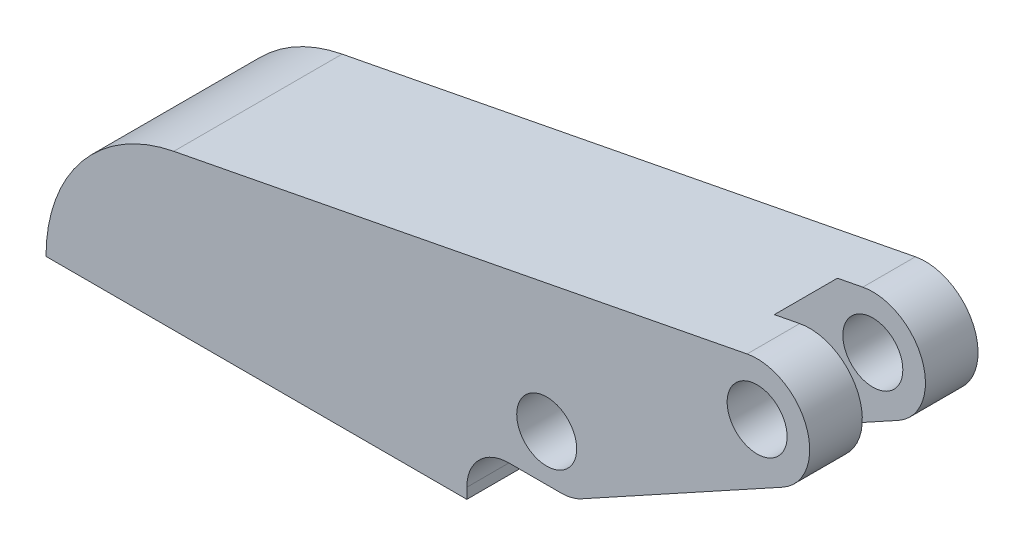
SolidWorks part; units mm, degrees
ref_plane "Front Plane" through (0, 0, 0) normal (0, 0, 1) x (1, 0, 0)
ref_plane "Top Plane" through (0, 0, 0) normal (0, 1, 0) x (1, 0, 0)
ref_plane "Right Plane" through (0, 0, 0) normal (1, 0, 0) x (0, 0, -1)
imported_body "Imported1"
ref_plane "Plane1" through (0, 0, 0) normal (0, 0, -1) x (-1, 0, 0)
sketch "Sketch1" plane through (0, 0, 0) normal (0, 0, -1) x (-1, 0, 0)
  line L0 (-42.5904, 4.7434) -> (-42.5904, 12.0521)
  line L1 (-42.5904, 12.0521) -> (-66.6693, 25.2955)
  line L2 (-70, 16) -> (-50.9002, 5.4951)
  line L3 (-48.9726, 5) -> (-44, 5)
  circle A0 centre (-47.5904, 9.3811) radius 2.85
  circle A1 centre (-67.5904, 20.3811) radius 2.85
  arc A2 (-66.6693, 25.2955) -> (-70, 16) centre (-67.5904, 20.3811) ccw
  arc A3 (-50.9002, 5.4951) -> (-48.9726, 5) centre (-48.9726, 9) ccw
  arc A4 (-44, 5) -> (-42.5904, 4.7434) centre (-44, 1) cw
extrude "Boss-Extrude1" add sketch "Sketch1" against normal blind 5
other "Move Face1" parameters "D1"=0.762
